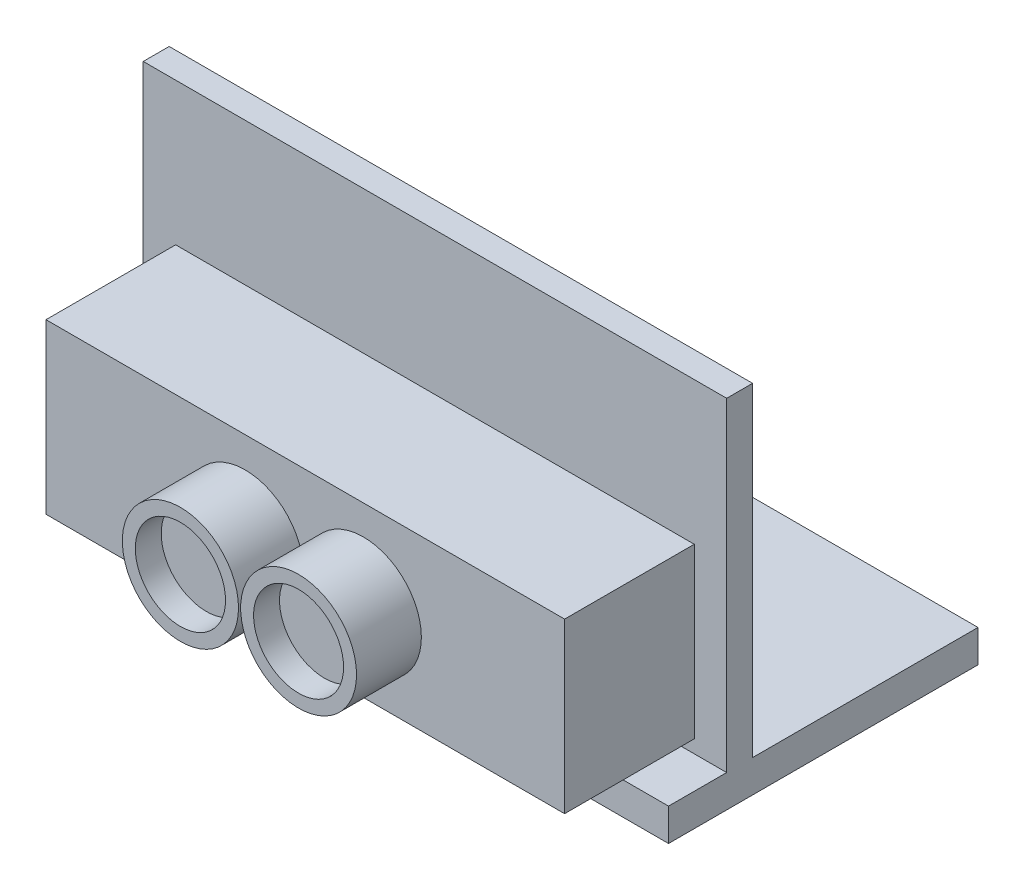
SolidWorks part; units mm, degrees
ref_plane "Front Plane" through (0, 0, 0) normal (0, 0, 1) x (1, 0, 0)
ref_plane "Top Plane" through (0, 0, 0) normal (0, 1, 0) x (1, 0, 0)
ref_plane "Right Plane" through (0, 0, 0) normal (1, 0, 0) x (0, 0, -1)
sketch "Sketch1" plane through (0, 0, 0) normal (0, 0, 1) x (1, 0, 0)
  line L1 (-22.5, 12.5) -> (22.5, 12.5)
  line L2 (-22.5, 12.5) -> (-22.5, -12.5)
  line L3 (-22.5, -12.5) -> (22.5, -12.5)
  line L4 (22.5, 12.5) -> (22.5, -12.5)
  line L5 (-22.5, 12.5) -> (22.5, -12.5) construction
  line L6 (-22.5, -12.5) -> (22.5, 12.5) construction
  point P0 (0, 0)
  dimension "D1" = 25
  dimension "D2" = 45
extrude "Boss-Extrude1" add sketch "Sketch1" along normal blind 2
sketch "Sketch2" plane through (0, 0, 2) normal (0, 0, 1) x (1, 0, 0)
  line L0 (0, 12.5) -> (0, -12.5) construction
  line L1 (22.5, 12.5) -> (-22.5, 12.5) construction
  line L2 (-22.5, -12.5) -> (22.5, -12.5) construction
  line L4 (-20, 1.5) -> (20, 1.5)
  line L5 (-20, 1.5) -> (-20, -11.5)
  line L6 (-20, -11.5) -> (20, -11.5)
  line L7 (20, 1.5) -> (20, -11.5)
  line L8 (-20, 1.5) -> (20, -11.5) construction
  line L9 (-20, -11.5) -> (20, 1.5) construction
  point P6 (0, -5)
  dimension "D1" = 13
  dimension "D2" = 40
  dimension "D3" = 1
extrude "Boss-Extrude2" add sketch "Sketch2" along normal blind 10
sketch "Sketch9" plane through (0, 0, 12) normal (0, 0, 1) x (1, 0, 0)
  line L0 (20.012, -5.2407) -> (-19.988, -5.2407) construction
  line L1 (1.146, -0.5159) -> (8.012, -10.2407) construction
  line L2 (1.146, -9.9654) -> (8.012, -0.2407) construction
  line L3 (-1.413, -0.3138) -> (-7.84, -10.3278) construction
  line L4 (-1.1934, -10.0091) -> (-8.2425, -0.4217) construction
  circle A0 centre (4.4819, -5.2407) radius 4.4698
  circle A1 centre (-4.633, -5.3309) radius 4.4802
  point P6 (4.4819, -5.2407)
  point P13 (-4.633, -5.3309)
  point P16 (0, 0)
  point P50 (0, 0)
extrude "Boss-Extrude8" add sketch "Sketch9" along normal blind 5
sketch "Sketch10" plane through (0, 0, 17) normal (0, 0, 1) x (1, 0, 0)
  arc A2 (7.9517, -5.2407) -> (7.9517, -5.2407) centre (4.4819, -5.2407) ccw
  circle A3 centre (4.4819, -5.2407) radius 3.4698
  circle A5 centre (-4.633, -5.3309) radius 3.4802
  circle A6 centre (-4.633, -5.3309) radius 3.4802
  dimension "D1" = 1
  dimension "D2" = 1
extrude "Cut-Extrude5" cut sketch "Sketch10" against normal blind 2
sketch "Sketch12" plane through (0, -12.5, 0) normal (0, -1, 0) x (1, 0, 0)
  line L0 (22.5, 2) -> (22.5, 0) construction
  line L1 (-22.5, -17.3855) -> (22.5, -17.3855)
  line L2 (-22.5, -17.3855) -> (-22.5, 6.4851)
  line L3 (-22.5, 6.4851) -> (22.5, 6.4851)
  line L4 (22.5, -17.3855) -> (22.5, 6.4851)
  line L5 (-22.5, 2) -> (-22.5, 0) construction
  point P6 (22.5, 1)
extrude "Boss-Extrude11" add sketch "Sketch12" along normal blind 2.5
sketch "Sketch13" plane through (0, -12.5, 0) normal (0, 1, 0) x (1, 0, 0)
  line L0 (-0.1528, -17) -> (-0.1528, 20.337) construction
  circle A0 centre (-0.1528, 13.7481) radius 1.5
extrude "Cut-Extrude6" cut sketch "Sketch13" against normal blind 2.5
